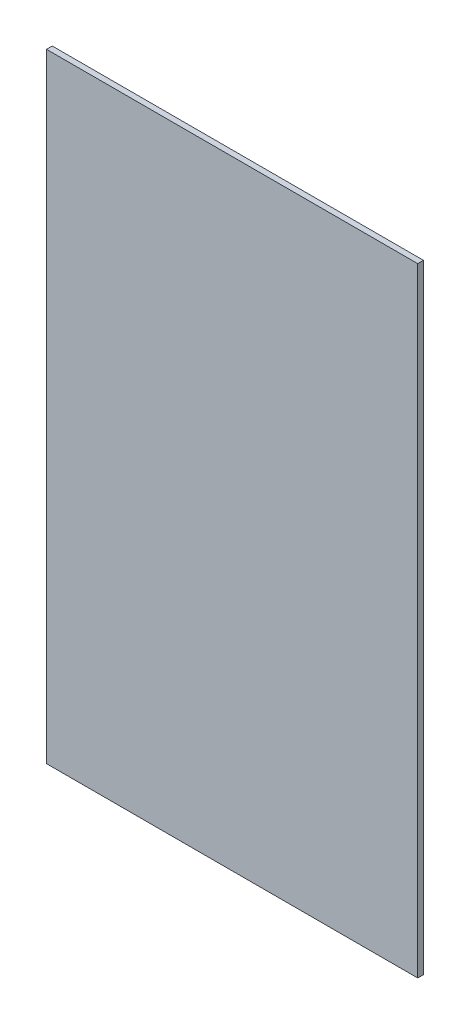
SolidWorks part; units mm, degrees
ref_plane "Front Plane" through (0, 0, 0) normal (0, 0, 1) x (1, 0, 0)
ref_plane "Top Plane" through (0, 0, 0) normal (0, 1, 0) x (1, 0, 0)
ref_plane "Right Plane" through (0, 0, 0) normal (1, 0, 0) x (0, 0, -1)
sketch "Sketch1" plane through (0, 0, 0) normal (0, 0, 1) x (1, 0, 0)
  line L1 (-76.2, -127) -> (76.2, -127)
  line L2 (-76.2, -127) -> (-76.2, 127)
  line L3 (-76.2, 127) -> (76.2, 127)
  line L4 (76.2, -127) -> (76.2, 127)
  line L5 (-76.2, -127) -> (76.2, 127) construction
  line L6 (-76.2, 127) -> (76.2, -127) construction
  point P0 (0, 0)
  dimension "D1" = 254
  dimension "D2" = 152.4
extrude "Boss-Extrude1" add sketch "Sketch1" along normal blind 2.3622
